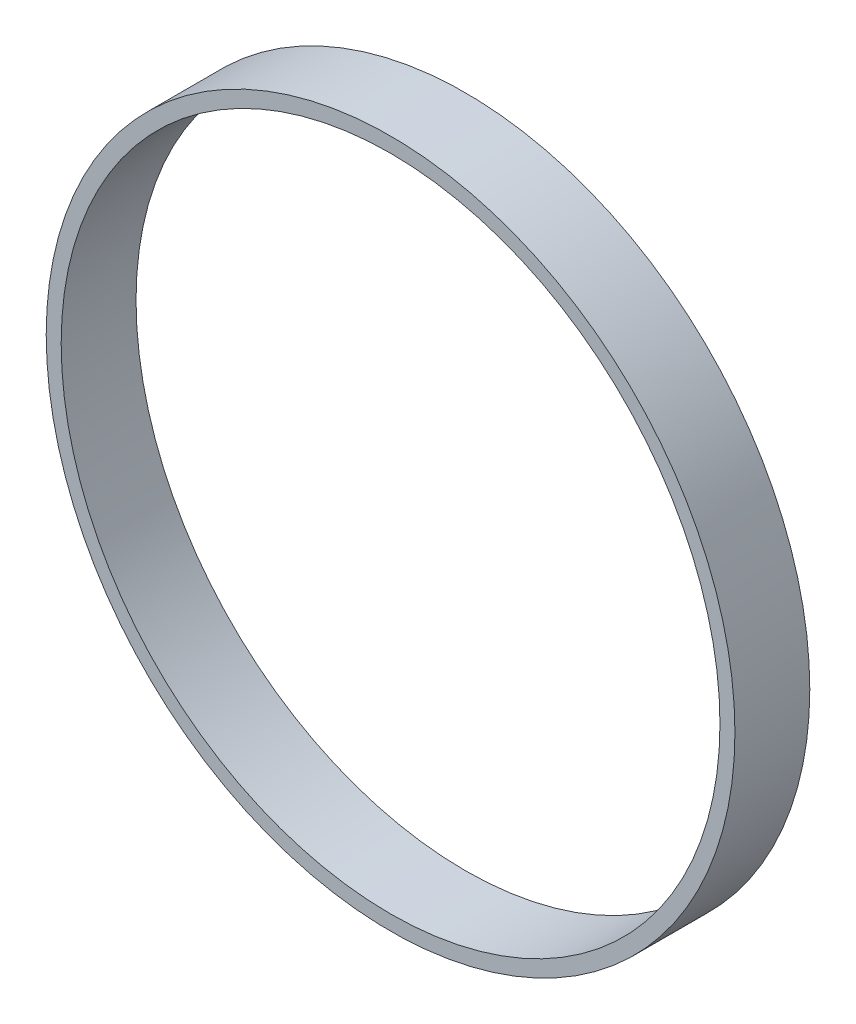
SolidWorks part; units mm, degrees
ref_plane "Plan de face" through (0, 0, 0) normal (0, 0, 1) x (1, 0, 0)
ref_plane "Plan de dessus" through (0, 0, 0) normal (0, 1, 0) x (1, 0, 0)
ref_plane "Plan de droite" through (0, 0, 0) normal (1, 0, 0) x (0, 0, -1)
sketch "Esquisse1" plane through (0, 0, 0) normal (0, 0, 1) x (1, 0, 0)
  circle A0 centre (0, 0) radius 22
  circle A1 centre (0, 0) radius 23
  dimension "D1" = 44
  dimension "D2" = 46
extrude "Extrusion1" add sketch "Esquisse1" along normal blind 5
